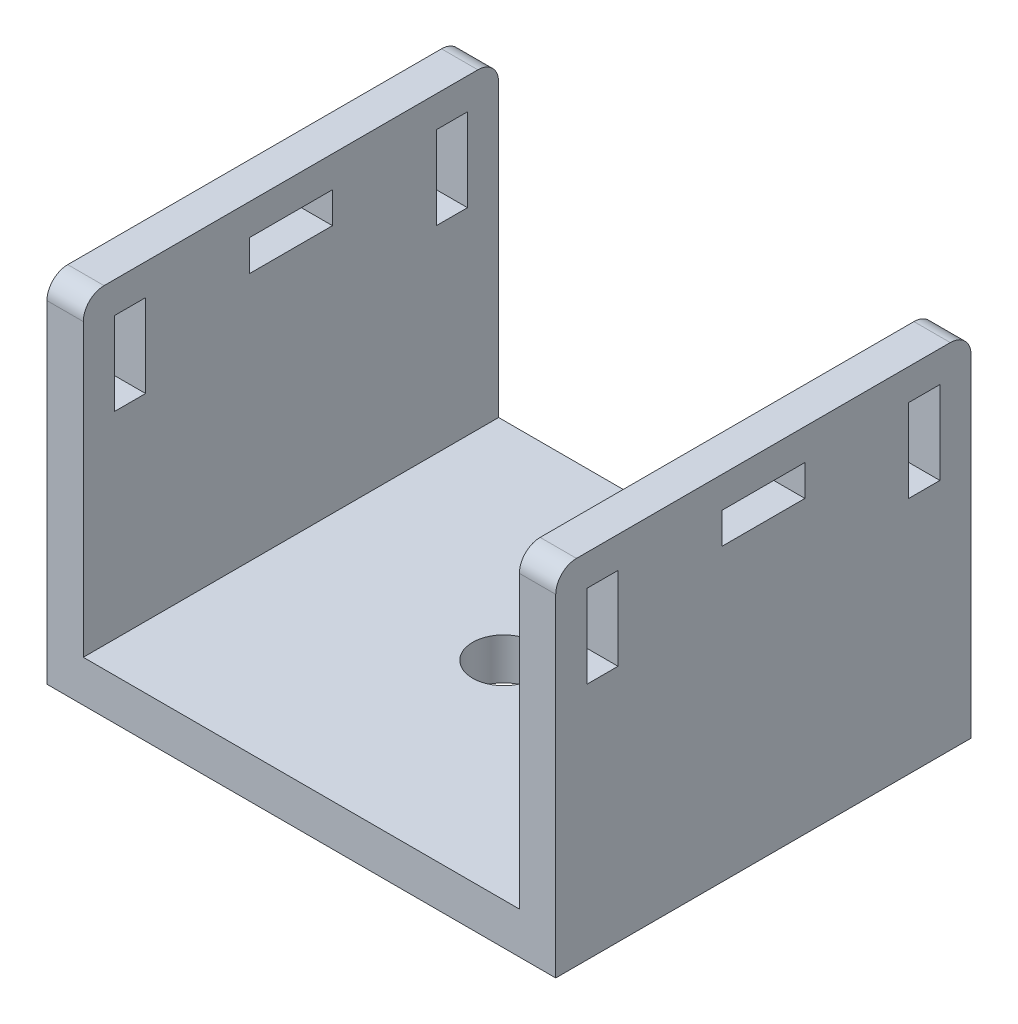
SolidWorks part; units mm, degrees
ref_plane "Plan de face" through (0, 0, 0) normal (0, 0, 1) x (1, 0, 0)
ref_plane "Plan de dessus" through (0, 0, 0) normal (0, 1, 0) x (1, 0, 0)
ref_plane "Plan de droite" through (0, 0, 0) normal (1, 0, 0) x (0, 0, -1)
sketch "Esquisse1" plane through (0, 0, 0) normal (0, 0, 1) x (1, 0, 0)
  line L0 (0, 17) -> (0, 0)
  line L1 (0, 0) -> (24.5, 0)
  line L2 (24.5, 0) -> (24.5, 17)
  line L3 (24.5, 17) -> (22.75, 17)
  line L4 (22.75, 17) -> (22.75, 2)
  line L5 (22.75, 2) -> (1.75, 2)
  line L6 (1.75, 2) -> (1.75, 17)
  line L7 (1.75, 17) -> (0, 17)
  dimension "D1" = 21
  dimension "D2" = 1.75
  dimension "D3" = 2
  dimension "D4" = 1.75
  dimension "D5" = 15
  dimension "D6" = 15
extrude "Boss.-Extru.1" add sketch "Esquisse1" along normal blind 20
sketch "Esquisse2" plane through (24.5, 0, 0) normal (1, 0, 0) x (0, 0, -1)
  line L0 (-20, 17) -> (0, 17) construction
  line L1 (-12, 15.5) -> (-8, 15.5)
  line L2 (-12, 15.5) -> (-12, 14)
  line L3 (-12, 14) -> (-8, 14)
  line L4 (-8, 15.5) -> (-8, 14)
  line L5 (0, 0) -> (0, 17) construction
  line L6 (-20, 0) -> (-20, 17) construction
  line L7 (-18.5, 15.5) -> (-17, 15.5)
  line L8 (-18.5, 15.5) -> (-18.5, 11.5)
  line L9 (-18.5, 11.5) -> (-17, 11.5)
  line L10 (-17, 15.5) -> (-17, 11.5)
  line L11 (-10, 19.4056) -> (-10, -2.1677) construction
  line L12 (-1.5, 11.5) -> (-3, 11.5)
  line L13 (-3, 15.5) -> (-3, 11.5)
  line L14 (-1.5, 15.5) -> (-3, 15.5)
  line L15 (-1.5, 15.5) -> (-1.5, 11.5)
  dimension "D1" = 4
  dimension "D2" = 1.5
  dimension "D3" = 1.5
  dimension "D4" = 8
  dimension "D5" = 4
  dimension "D6" = 1.5
  dimension "D7" = 1.5
  dimension "D8" = 1.5
  dimension "D9" = 10
extrude "Enlèv. mat.-Extru.1" cut sketch "Esquisse2" against normal blind 30
sketch "Esquisse3" plane through (0, 2, 0) normal (0, 1, 0) x (1, 0, 0)
  circle A0 centre (12, -10) radius 1.5
extrude "Enlèv. mat.-Extru.2" cut sketch "Esquisse3" against normal blind 30
fillet "Congé1" radius 1 4 edges at (23.625, 17, 0) (23.625, 17, 20) (0.875, 17, 20) (0.875, 17, 0)
